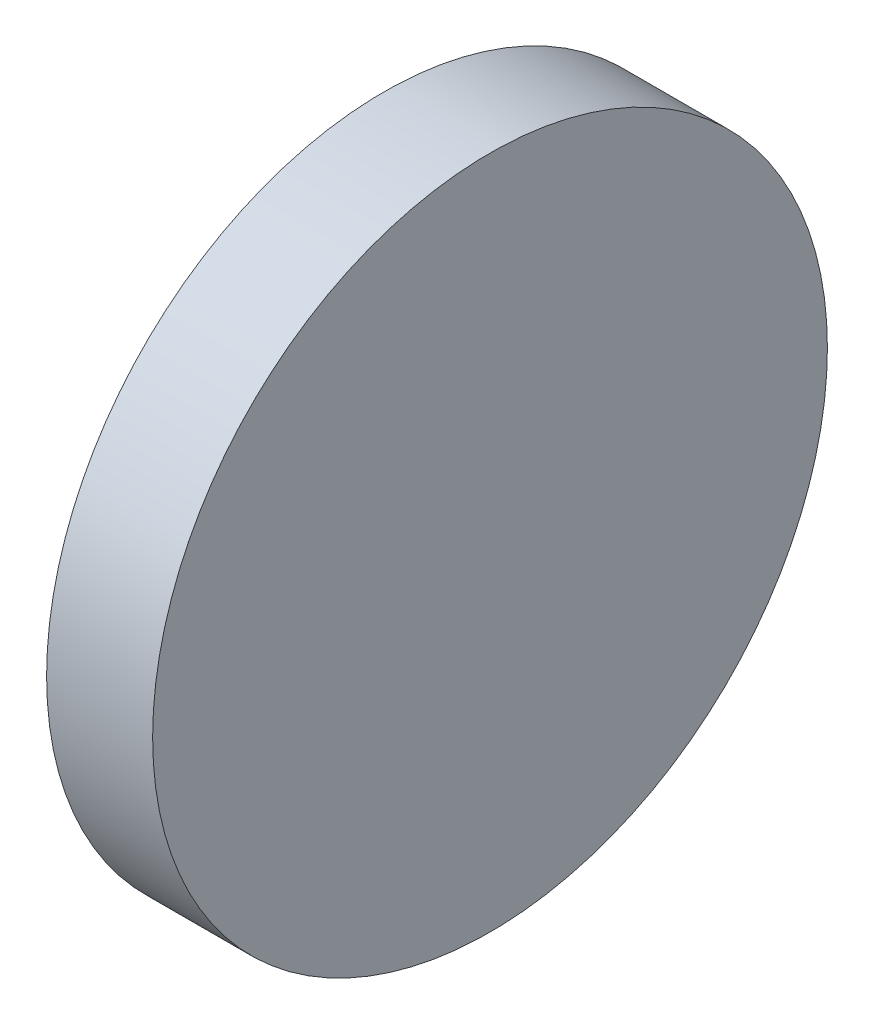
SolidWorks part; units mm, degrees
ref_plane "Front Plane" through (0, 0, 0) normal (1, 0, 0) x (0, 1, 0)
ref_plane "Top Plane" through (0, 0, 0) normal (0, 0, 1) x (0, 1, 0)
ref_plane "Right Plane" through (0, 0, 0) normal (0, 1, 0) x (-1, 0, 0)
sketch "Sketch1" plane through (0, 0, 0) normal (1, 0, 0) x (0, 1, 0)
  circle A0 centre (0, 0) radius 8.89
extrude "Circular_section" add sketch "Sketch1" along normal blind 2.794
